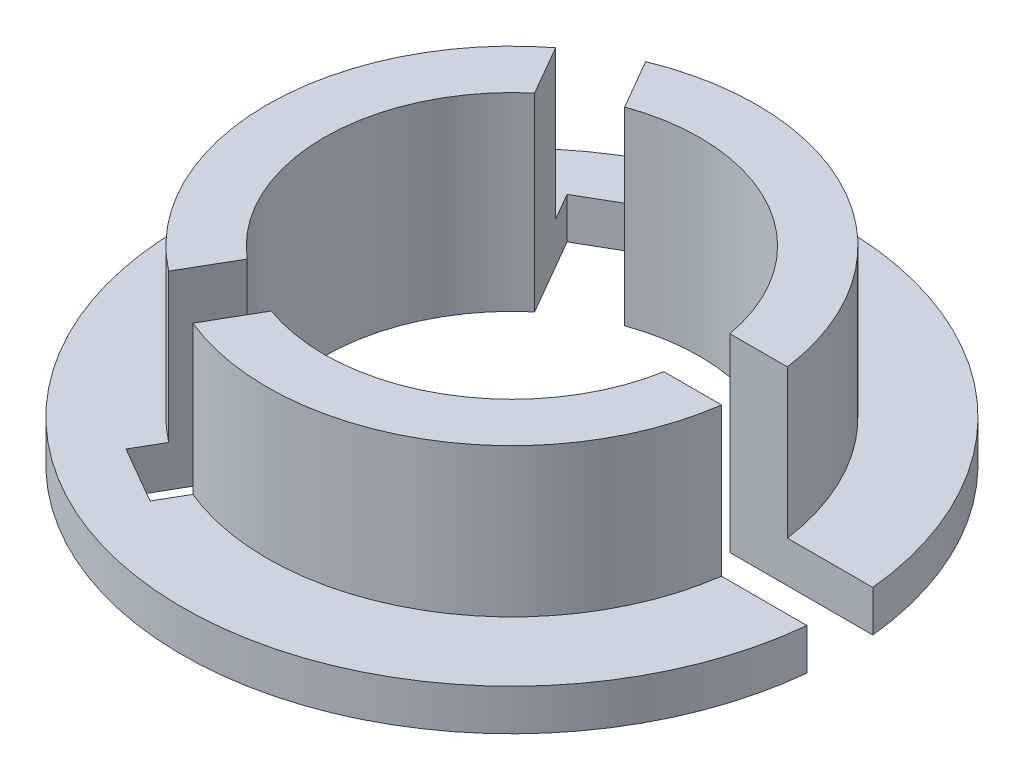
SolidWorks part; units mm, degrees
ref_plane "Front Plane" through (0, 0, 0) normal (0, 0, 1) x (1, 0, 0)
ref_plane "Top Plane" through (0, 0, 0) normal (0, 1, 0) x (1, 0, 0)
ref_plane "Right Plane" through (0, 0, 0) normal (1, 0, 0) x (0, 0, -1)
sketch "Sketch1" plane through (0, 0, 0) normal (0, 1, 0) x (1, 0, 0)
  circle A0 centre (0, 0) radius 29.7
  circle A1 centre (0, 0) radius 22.8
  dimension "D1" = 59.4
  dimension "D2" = 45.6
extrude "Boss-Extrude1" add sketch "Sketch1" along normal blind 18
sketch "Sketch2" plane through (0, 0, 0) normal (0, -1, 0) x (1, 0, 0)
  circle A0 centre (0, 0) radius 22.8
  circle A1 centre (0, 0) radius 40
  circle A2 centre (0, 0) radius 22.8 construction
  dimension "D1" = 80
extrude "Boss-Extrude2" add sketch "Sketch2" along normal blind 5
sketch "Sketch3" plane through (0, -5, 0) normal (0, -1, 0) x (1, 0, 0)
  line L0 (-53.2853, 0) -> (57.5009, 0) construction
  line L1 (-13.1454, -30.7685) -> (-4.8828, -16.4573)
  line L2 (33.219, 4) -> (16.6938, 4)
  line L3 (33.219, 4) -> (33.219, -4)
  line L4 (33.219, -4) -> (16.6938, -4)
  line L5 (16.6938, 4) -> (16.6938, -4)
  line L6 (-13.1454, -30.7685) -> (-20.0736, -26.7685)
  line L7 (-20.0736, -26.7685) -> (-11.811, -12.4573)
  line L8 (-4.8828, -16.4573) -> (-11.811, -12.4573)
  line L9 (-20.0736, 26.7685) -> (-11.811, 12.4573)
  line L10 (-20.0736, 26.7685) -> (-13.1454, 30.7685)
  line L11 (-13.1454, 30.7685) -> (-4.8828, 16.4573)
  line L12 (-11.811, 12.4573) -> (-4.8828, 16.4573)
  point P7 (33.219, -4)
  point P18 (0, 0)
  dimension "D1" = 8
  dimension "D2" = 3
extrude "Cut-Extrude1" cut sketch "Sketch3" against normal through all
sketch "Sketch4" plane through (0, -5, 0) normal (0, -1, 0) x (1, 0, 0)
  line L1 (33.219, 4) -> (43.956, 4)
  line L2 (33.219, 4) -> (33.219, -4)
  line L3 (33.219, -4) -> (43.956, -4)
  line L4 (43.956, 4) -> (43.956, -4)
extrude "Cut-Extrude2" cut sketch "Sketch4" against normal through all
